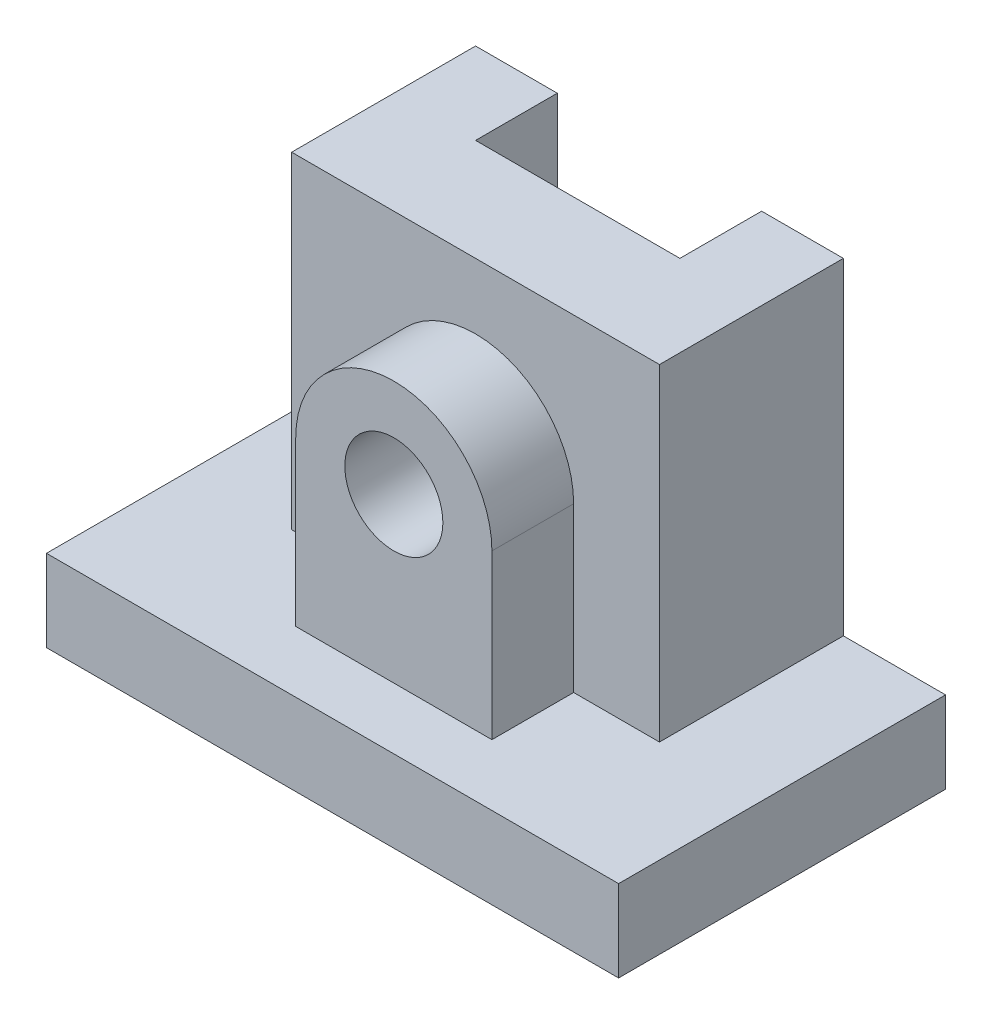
SolidWorks part; units mm, degrees
ref_plane "前视基准面" through (0, 0, 0) normal (0, 0, 1) x (1, 0, 0)
ref_plane "上视基准面" through (0, 0, 0) normal (0, 1, 0) x (1, 0, 0)
ref_plane "右视基准面" through (0, 0, 0) normal (1, 0, 0) x (0, 0, -1)
sketch "草图1" plane through (0, 0, 0) normal (0, 1, 0) x (1, 0, 0)
  line L0 (0, 0) -> (0, -101.1621) construction
  line L1 (-70, 0) -> (70, 0)
  line L2 (-70, 0) -> (-70, -80)
  line L3 (-70, -80) -> (70, -80)
  line L4 (70, 0) -> (70, -80)
  dimension "D1" = 140
  dimension "D2" = 80
extrude "拉伸1" add sketch "草图1" along normal blind 20
sketch "草图2" plane through (0, 20, 0) normal (0, 1, 0) x (1, 0, 0)
  line L0 (70, 0) -> (-70, 0) construction
  line L1 (-45, 0) -> (45, 0)
  line L2 (-45, 0) -> (-45, -45)
  line L3 (-45, -45) -> (45, -45)
  line L4 (45, 0) -> (45, -45)
  line L5 (0, 0) -> (0, -65.2554) construction
  dimension "D1" = 90
  dimension "D2" = 45
extrude "拉伸2" add sketch "草图2" along normal blind 80
sketch "草图3" plane through (0, 0, 45) normal (0, 0, 1) x (1, 0, 0)
  line L0 (0, 0) -> (0, 113.4739) construction
  line L1 (24, 20) -> (-24, 20)
  line L2 (-70, 20) -> (70, 20) construction
  line L3 (-45, 20) -> (45, 20) construction
  line L4 (-24, 20) -> (-24, 60)
  line L5 (24, 60) -> (24, 20)
  arc A0 (-24, 60) -> (24, 60) centre (0, 60) cw
  dimension "D1" = 24
  dimension "D2" = 40
extrude "拉伸3" add sketch "草图3" along normal blind 20
sketch "草图4" plane through (0, 0, 65) normal (0, 0, 1) x (1, 0, 0)
  circle A0 centre (0, 60) radius 12
  arc A3 (24, 60) -> (-24, 60) centre (0, 60) ccw construction
  dimension "D1" = 24
extrude "切除-拉伸1" cut sketch "草图4" against normal through all
sketch "草图5" plane through (0, 100, 0) normal (0, 1, 0) x (1, 0, 0)
  line L0 (45, 0) -> (-45, 0) construction
  line L1 (-25, 0) -> (25, 0)
  line L2 (-25, 0) -> (-25, -20)
  line L3 (-25, -20) -> (25, -20)
  line L4 (25, 0) -> (25, -20)
  line L5 (0, 0) -> (0, -40) construction
  dimension "D1" = 50
  dimension "D2" = 20
extrude "切除-拉伸2" cut sketch "草图5" against normal through all
